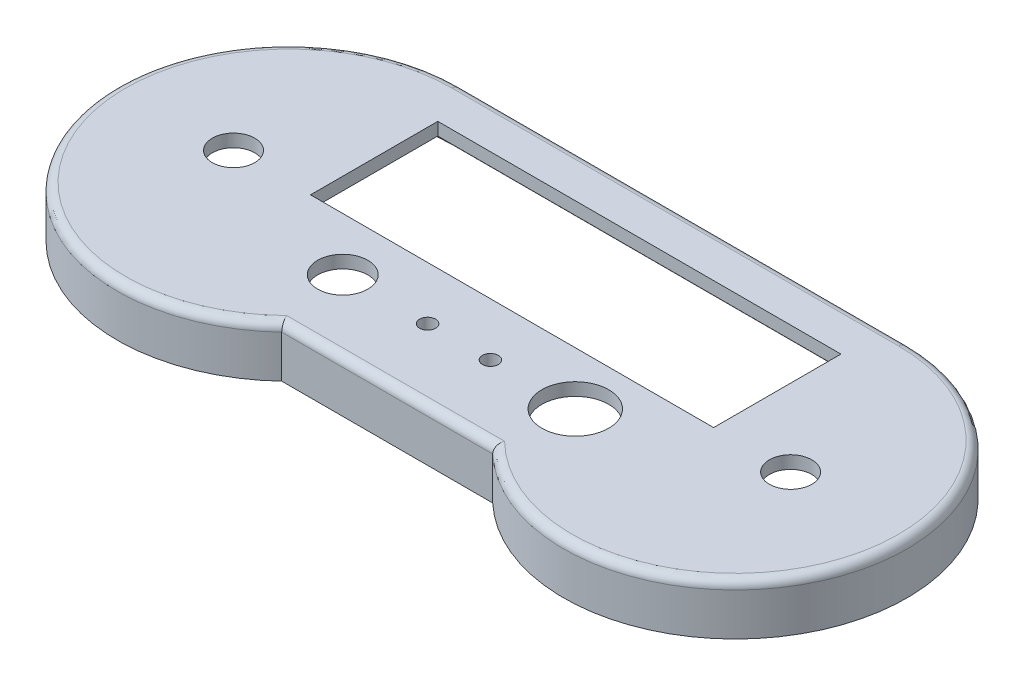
SolidWorks part; units mm, degrees
ref_plane "Front Plane" through (0, 0, 0) normal (0, 0, 1) x (1, 0, 0)
ref_plane "Top Plane" through (0, 0, 0) normal (0, 1, 0) x (1, 0, 0)
ref_plane "Right Plane" through (0, 0, 0) normal (1, 0, 0) x (0, 0, -1)
sketch "Sketch1" plane through (0, 0, 0) normal (0, 1, 0) x (1, 0, 0)
  line L0 (-66.8306, 51.3754) -> (66.8306, 51.3754)
  line L1 (31.5686, -37.3634) -> (-31.5686, -37.3634)
  arc A0 (31.5686, -37.3634) -> (66.8306, 51.3754) centre (66.8306, 0) ccw
  arc A1 (-66.8306, 51.3754) -> (-31.5686, -37.3634) centre (-66.8306, 0) ccw
  point P7 (0, 51.3754)
  dimension "D1" = 133.6612
  dimension "D2" = 51.3754
  dimension "D3" = 88.7389
extrude "Boss-Extrude1" add sketch "Sketch1" along normal blind 15.24
shell "Shell1" thickness 3.81
fillet "Fillet1" radius 2.54 4 edges at (0, 15.24, 37.3634) (-114.5747, 15.24, 18.972) (0, 15.24, -51.3754) (114.5747, 15.24, 18.972)
sketch "Sketch2" plane through (0, 15.24, 0) normal (0, 1, 0) x (1, 0, 0)
  line L0 (-34.798, -15.875) -> (-9.398, -15.875)
  line L1 (-60.325, 0) -> (60.325, 0)
  line L2 (-60.325, 0) -> (-60.325, 38.1)
  line L3 (-60.325, 38.1) -> (60.325, 38.1)
  line L4 (60.325, 0) -> (60.325, 38.1)
  line L5 (-9.398, -15.875) -> (0, -15.875)
  line L6 (0, -15.875) -> (9.398, -15.875)
  line L7 (9.398, -15.875) -> (34.798, -15.875)
  line L8 (0, -55) -> (0, 55) construction
  circle A0 centre (-83.3649, 0) radius 6.35
  circle A1 centre (-34.798, -15.875) radius 7.5
  circle A2 centre (34.798, -15.875) radius 10
  circle A3 centre (-9.398, -15.875) radius 2.3813
  circle A4 centre (9.398, -15.875) radius 2.3812
  circle A5 centre (83.3649, 0) radius 6.35
  dimension "D2" = 12.7
  dimension "D3" = 20
  dimension "D4" = 15
  dimension "D5" = 4.7625
  dimension "D6" = 4.7625
  dimension "D1" = 83.3649
  dimension "D7" = 38.1
  dimension "D8" = 120.65
  dimension "D9" = 25.4
  dimension "D10" = 9.398
  dimension "D11" = 15.875
extrude "Cut-Extrude2" cut sketch "Sketch2" against normal up to next contours A1 | A3 | A4 | A2 | L1 L4 L3 L2 | A0 | A5
other "Select Features1" parameters "GrooveHeight"=2.54, "GrooveWidth"=1.905, "GrooveDraftAngle"=3, "Clearance"=0, "Gap"=0, "upGap"=2.54, "D7"=1.905, "D8"=3, "D9"=0
other "Snap Groove1" parameters "HeightOffset"=0, "WidthOffset"=0, "Clearance"=0, "Gap"=0, "GapHeight"=2.54
other "Snap Groove2" parameters "HeightOffset"=0, "WidthOffset"=0, "Clearance"=0, "Gap"=0, "GapHeight"=2.54
other "Snap Groove3" parameters "HeightOffset"=0, "WidthOffset"=0, "Clearance"=0, "Gap"=0, "GapHeight"=2.54
